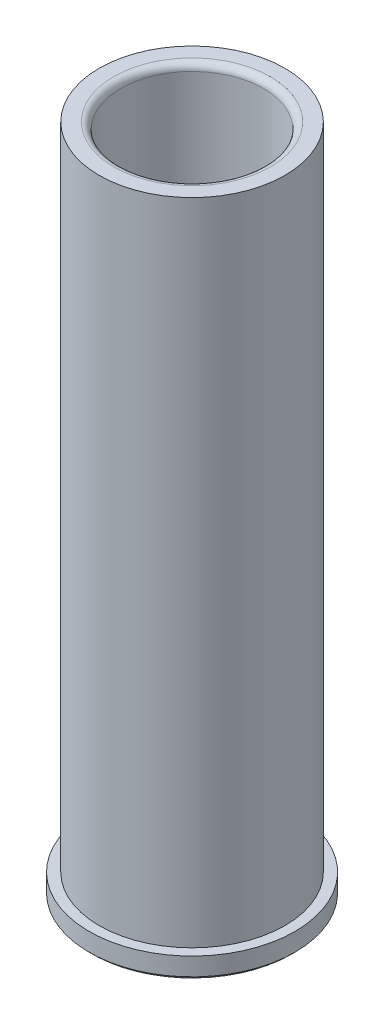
SolidWorks part; units mm, degrees
ref_plane "Front Plane" through (0, 0, 0) normal (0, 0, 1) x (1, 0, 0)
ref_plane "Top Plane" through (0, 0, 0) normal (0, 1, 0) x (1, 0, 0)
ref_plane "Right Plane" through (0, 0, 0) normal (1, 0, 0) x (0, 0, -1)
sketch "Sketch1" plane through (0, 0, 0) normal (0, 0, 1) x (1, 0, 0)
  line L0 (-22.1234, 0) -> (-22.8854, 0.762)
  line L1 (0, -1000) -> (0, 49000) construction
  line L2 (-15.8814, 149.225) -> (-15.8813, 0.762)
  line L3 (-16.6433, 0) -> (-22.1234, 0)
  line L4 (-22.8854, 0.762) -> (-22.8854, 4.7625)
  line L5 (-22.8854, 4.7625) -> (-20.6438, 4.7625)
  line L6 (-20.6439, 149.225) -> (-20.6438, 4.7625)
  line L7 (-20.6439, 149.225) -> (-15.8814, 149.225)
  line L8 (-16.6433, 0) -> (-15.8813, 0.762)
  dimension "OD" = 41.2877
  dimension "ID" = 31.7627
  dimension "H" = 45.7708
  dimension "D2" = 45
  dimension "OVERALL LENGTH" = 149.225
  dimension "D4" = 0.762
  dimension "D5" = 135
  dimension "T" = 4.7625
revolve "Revolve1" add sketch "Sketch1" angle 360 about L1
fillet "Fillet1" radius 1.524 1 edges at (15.8813, 149.225, 0)
